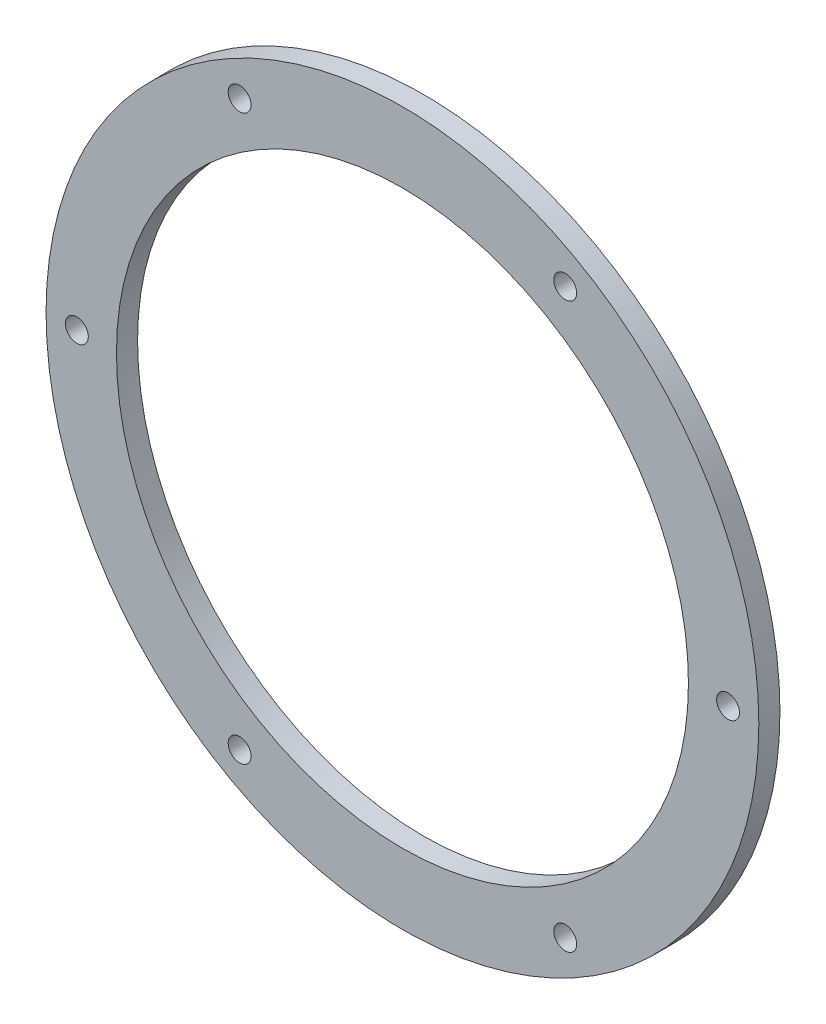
SolidWorks part; units mm, degrees
ref_plane "Front Plane" through (0, 0, 0) normal (0, 0, 1) x (1, 0, 0)
ref_plane "Top Plane" through (0, 0, 0) normal (0, 1, 0) x (1, 0, 0)
ref_plane "Right Plane" through (0, 0, 0) normal (1, 0, 0) x (0, 0, -1)
sketch "Sketch1" plane through (0, 0, 0) normal (0, 0, 1) x (1, 0, 0)
  circle A0 centre (0, 0) radius 162.5
  circle A1 centre (0, 0) radius 202.5
  dimension "D1" = 325
  dimension "D2" = 405
extrude "Boss-Extrude1" add sketch "Sketch1" along normal blind 12
sketch "Sketch2" plane through (0, 0, 0) normal (0, 0, -1) x (-1, 0, 0)
  circle A0 centre (185, 0) radius 6.5
  circle A1 centre (0, 0) radius 185 construction
  dimension "D1" = 370
  dimension "D2" = 13
extrude "Cut-Extrude1" cut sketch "Sketch2" against normal through all
pattern_circular "CirPattern1" count 6 over 360 about axis through (0, 0, 0) along (0, 0, 1) of "Cut-Extrude1"
